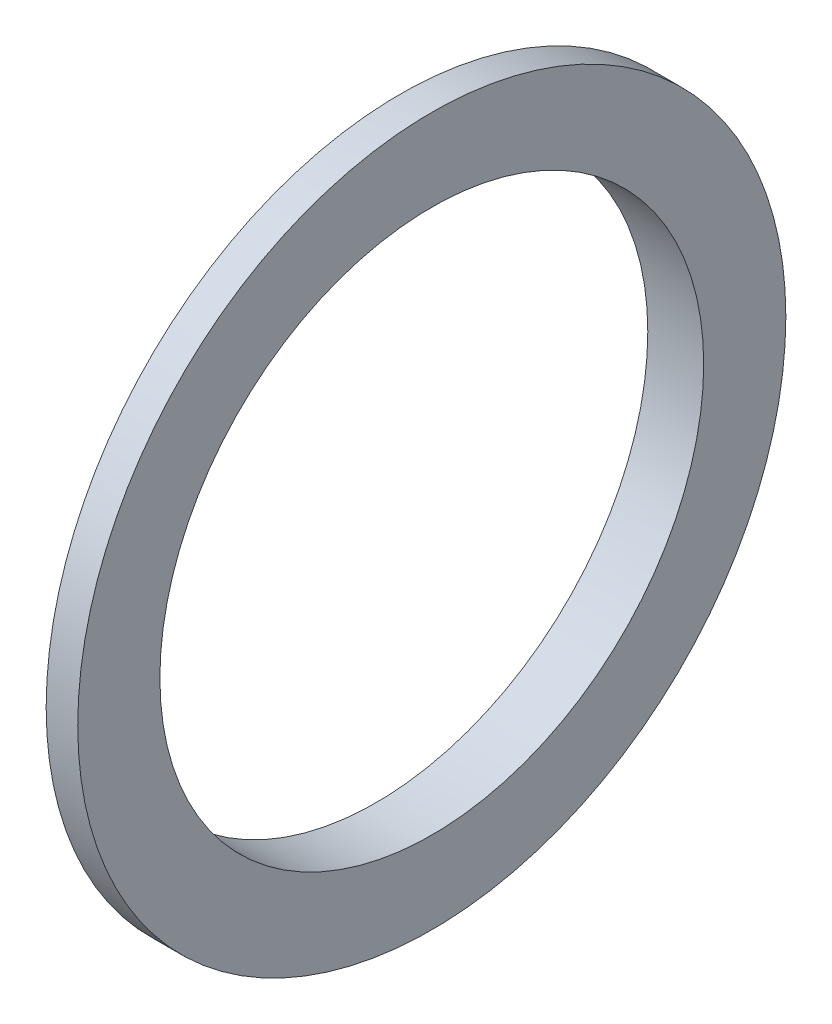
SolidWorks part; units mm, degrees
ref_plane "Front" through (0, 0, 0) normal (0, 0, 1) x (1, 0, 0)
ref_plane "Top" through (0, 0, 0) normal (0, 1, 0) x (1, 0, 0)
ref_plane "Right" through (0, 0, 0) normal (1, 0, 0) x (0, 0, -1)
sketch "Sketch1" plane through (0, 0, 0) normal (0, 0, 1) x (1, 0, 0)
  line L0 (-2.6897, 30.1625) -> (-2.8138, 30.1993) construction
  line L1 (-4.7625, 23.1648) -> (-2.6897, 30.1625)
  line L2 (-3.7261, 26.6636) -> (-3.852, 26.701) construction
  line L3 (-2.6897, 30.1625) -> (0, 30.1625)
  line L4 (0, 30.1625) -> (0, 23.1648)
  line L6 (0, 23.1648) -> (-4.7625, 23.1648)
  line L8 (0, 0) -> (-9.6818, 0) construction
  circle A1 centre (92.5303, 0) radius 101.6 construction
  circle A2 centre (92.5303, 0) radius 100.0125 construction
  dimension "D5" = 203.2
  dimension "D1" = 60.325
  dimension "D2" = 4.7625
  dimension "D3" = 46.3296
  dimension "D4" = 16.5
  dimension "D6" = 1.5875
revolve "Revolve1" add sketch "Sketch1" angle 360 about L8
